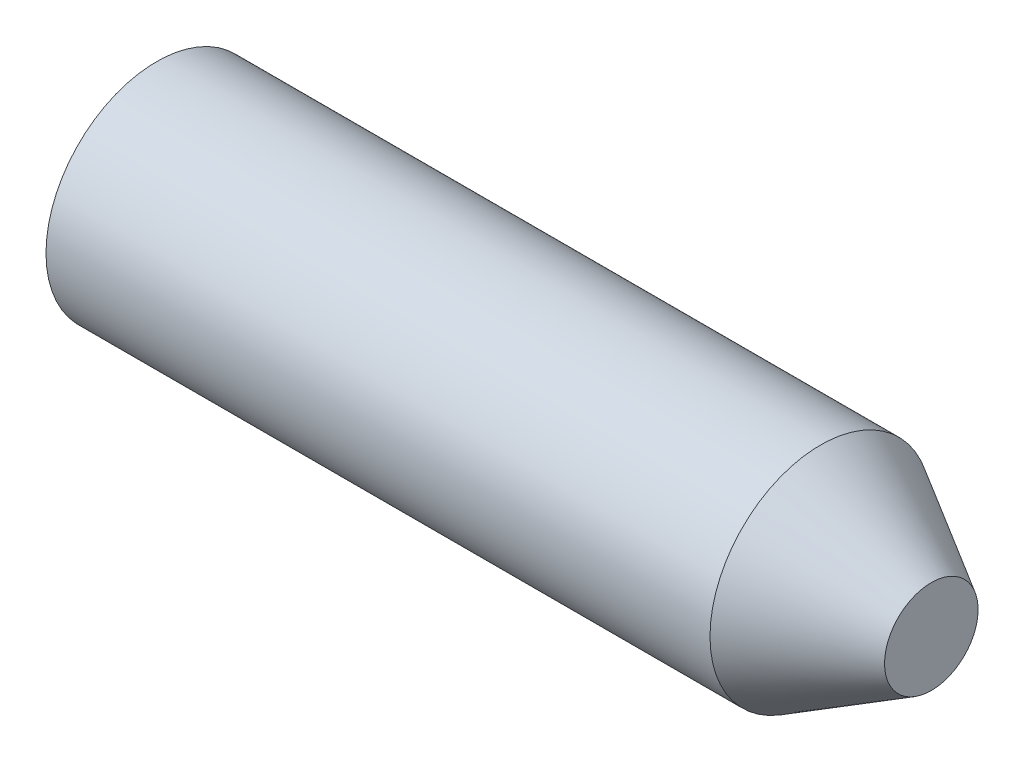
SolidWorks part; units mm, degrees
ref_plane "Front Plane" through (0, 0, 0) normal (0, 0, 1) x (1, 0, 0)
ref_plane "Top Plane" through (0, 0, 0) normal (0, 1, 0) x (1, 0, 0)
ref_plane "Right Plane" through (0, 0, 0) normal (1, 0, 0) x (0, 0, -1)
sketch "Sketch2" plane through (0, 0, 0) normal (0, 0, 1) x (1, 0, 0)
  line L0 (0, 0) -> (0, 10) construction
  line L1 (0, 0) -> (70, 0) construction
  line L2 (0, 10) -> (70, 10)
  line L3 (70, 10) -> (70, 14.2265)
  line L4 (70, 14.2265) -> (60, 20)
  line L5 (60, 20) -> (0, 20)
  line L6 (0, 20) -> (0, 10)
  dimension "D1" = 10
  dimension "D2" = 70
  dimension "D3" = 10
  dimension "D4" = 30
  dimension "D5" = 60
  dimension "D6" = 70
revolve "Revolve1" add sketch "Sketch2" angle 360 about L2
sketch "Sketch5" plane through (0, 0, 0) normal (-1, 0, 0) x (0, 0, 1)
  line L0 (0, 0) -> (0, 10) construction
  point P0 (0, 10)
hole_wizard "Ø16.0 (16) Diameter Hole1" positions "3DSketch2" profile "Sketch8" hole size "Ø16.0" standard "ISO"
sketch3d "3DSketch2"
  point P0 (0, 10, 0)
sketch "Sketch8" plane through (0, 10, 0) normal (0, 1, 0) x (0, 0, 1)
  line L0 (0, 0) -> (0, 19.8069)
  line L1 (0, 19.8069) -> (8, 15)
  line L2 (8, 15) -> (8, 0)
  line L5 (8, 0) -> (0, 0)
  line L10 (0, 19.8069) -> (-8, 15) construction
  line L11 (0, -6.35) -> (0, 107.95) construction
  dimension "Hole Dia." = 16
  dimension "Hole Depth" = 15
  dimension "Drill Angle" = 118
sketch "Sketch9" plane through (0, 0, 0) normal (0, 1, 0) x (1, 0, 0)
  line L0 (0, 0) -> (70, 0) construction
  line L1 (70, -4.2265) -> (70, 4.2265) construction
hole_wizard "M4 Tapped Hole3" positions "3DSketch7" profile "Sketch16" tap size "M4" standard "DIN"
sketch3d "3DSketch7"
  line L0 (0, 0, 0) -> (70, 0, 0) construction
  point P0 (30, 0, 0)
  dimension "D1" = 30
sketch "Sketch16" plane through (30, 0, 0) normal (1, 0, 0) x (0, 0, -1)
  line L0 (0, 0) -> (0, 13.0914)
  line L1 (0, 13.0914) -> (1.65, 12.1)
  line L2 (1.65, 12.1) -> (1.65, 0)
  line L5 (1.65, 0) -> (0, 0)
  line L10 (0, 13.0914) -> (-1.65, 12.1) construction
  line L11 (0, -6.35) -> (0, 107.95) construction
  dimension "Tap Drill Dia." = 3.3
  dimension "Tap Drill Depth" = 12.1
  dimension "Drill Angle" = 118
